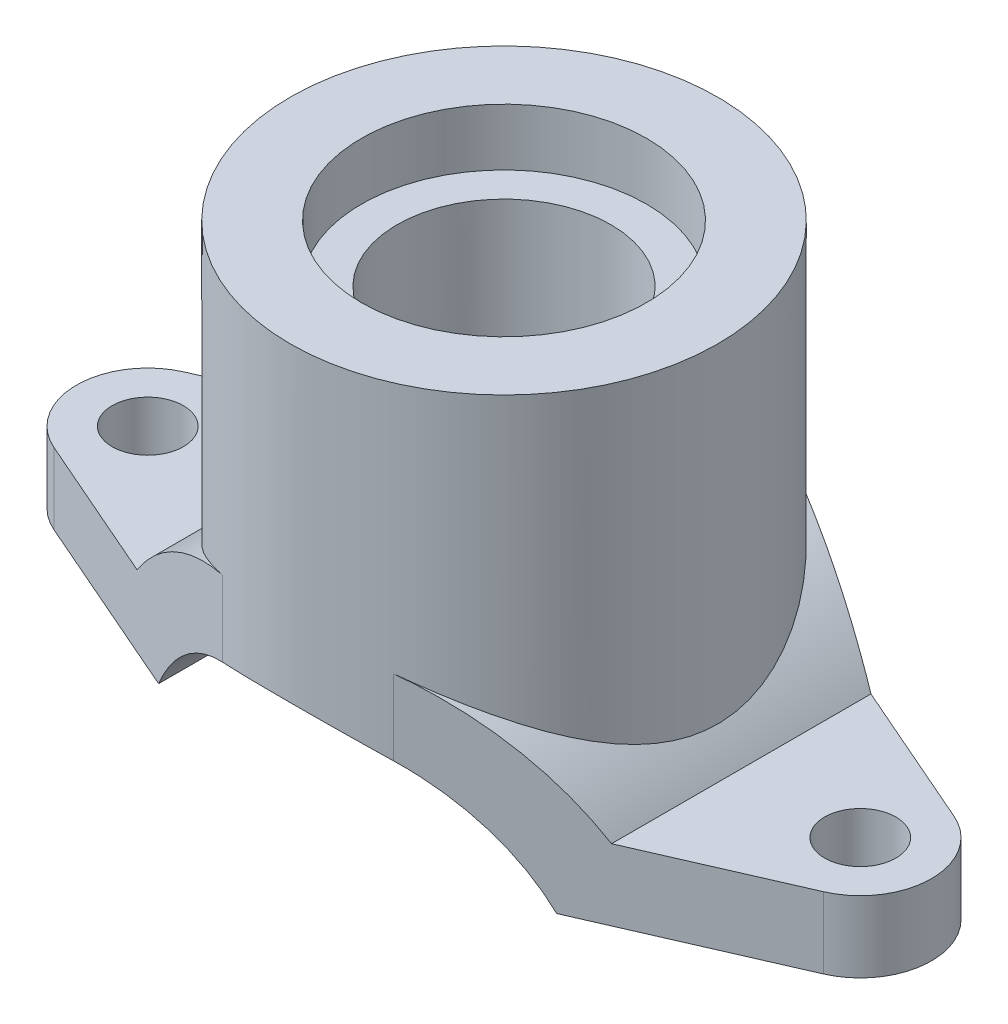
SolidWorks part; units mm, degrees
ref_plane "Front Plane" through (0, 0, 0) normal (0, 0, 1) x (1, 0, 0)
ref_plane "Top Plane" through (0, 0, 0) normal (0, 1, 0) x (1, 0, 0)
ref_plane "Right Plane" through (0, 0, 0) normal (1, 0, 0) x (0, 0, -1)
sketch "Sketch1" plane through (0, 0, 0) normal (0, 0, 1) x (1, 0, 0)
  line L0 (-150, 0) -> (-69.8498, 0)
  line L1 (69.8498, 0) -> (150, 0)
  line L2 (150, 0) -> (150, 25)
  line L3 (150, 25) -> (83.2406, 25)
  line L4 (-83.2406, 25) -> (-150, 25)
  line L5 (-150, 25) -> (-150, 0)
  arc A2 (-83.2406, 25) -> (83.2406, 25) centre (0, -39) cw
  arc A3 (-69.8498, 0) -> (69.8498, 0) centre (0, -39) cw
  dimension "D4" = 105
  dimension "D5" = 80
  dimension "D1" = 25
  dimension "D2" = 300
  dimension "D3" = 39
extrude "Boss-Extrude1" add sketch "Sketch1" along normal mid plane 150
ref_plane "Plane1" through (0, 66, 75) normal (0, 1, 0) x (-1, 0, 0)
sketch "Sketch2" plane through (0, 66, 75) normal (0, 1, 0) x (-1, 0, 0)
  line L0 (-135, -97.9129) -> (-30, -143.7386)
  line L1 (135, -97.9129) -> (30, -143.7386)
  line L2 (-135, -52.0871) -> (-30, -6.2614)
  line L3 (135, -52.0871) -> (30, -6.2614)
  line L4 (150, 0) -> (150, -150) construction
  arc A0 (-135, -52.0871) -> (-135, -97.9129) centre (-125, -75) ccw
  arc A1 (135, -97.9129) -> (135, -52.0871) centre (125, -75) ccw
  arc A2 (-30, -143.7386) -> (30, -143.7386) centre (0, -75) ccw
  arc A3 (30, -6.2614) -> (-30, -6.2614) centre (0, -75) ccw
  dimension "D1" = 75
  dimension "D2" = 25
  dimension "D3" = 250
extrude "Cut-Extrude1" cut sketch "Sketch2" against normal through all flip side to cut
ref_plane "Plane2" through (0, 150, 0) normal (0, 1, 0) x (1, 0, 0)
sketch "Sketch3" plane through (0, 150, 0) normal (0, 1, 0) x (1, 0, 0)
  circle A0 centre (0, 0) radius 75
  dimension "D1" = 150
extrude "Boss-Extrude2" add sketch "Sketch3" against normal up to surface (84 mm away)
sketch "Sketch4" plane through (0, 0, 0) normal (0, 0, 1) x (1, 0, 0)
  line L0 (0, 0) -> (0, 162.0049) construction
  line L1 (0, 150) -> (50, 150)
  line L2 (75, 150) -> (-75, 150) construction
  line L3 (50, 150) -> (50, 130)
  line L4 (50, 130) -> (37.5, 130)
  line L5 (37.5, 130) -> (37.5, 0)
  line L6 (37.5, 0) -> (0, 0)
  line L7 (0, 0) -> (0, 150)
  dimension "D1" = 20
  dimension "D2" = 75
  dimension "D3" = 100
revolve "Cut-Revolve1" cut sketch "Sketch4" angle 360 about L0
sketch "Sketch5" plane through (0, 25, 0) normal (0, 1, 0) x (1, 0, 0)
  circle A0 centre (-125, 0) radius 12.5
  circle A1 centre (125, 0) radius 12.5
  dimension "D1" = 25
extrude "Cut-Extrude2" cut sketch "Sketch5" against normal through all
